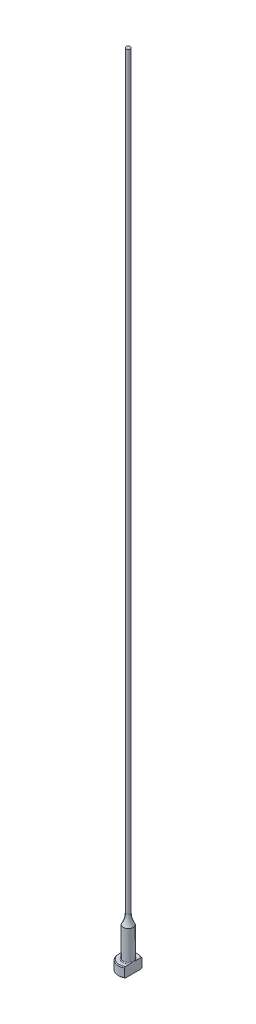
SolidWorks part; units mm, degrees
ref_plane "Front Plane" through (0, 0, 0) normal (0, 0, 1) x (1, 0, 0)
ref_plane "Top Plane" through (0, 0, 0) normal (0, 1, 0) x (1, 0, 0)
ref_plane "Right Plane" through (0, 0, 0) normal (1, 0, 0) x (0, 0, -1)
sketch "Sketch1" plane through (0, 0, 0) normal (0, 0, 1) x (1, 0, 0)
  line L0 (0, 259.9588) -> (0, -15.1925) construction
  line L1 (0, 0) -> (-3.175, 0)
  line L2 (-3.175, 0) -> (-3.175, 3.175)
  line L3 (-3.175, 3.175) -> (-1.5875, 3.175)
  line L4 (-0.6579, 16.0079) -> (-0.6579, 254)
  line L5 (-0.6579, 254) -> (0, 254)
  line L6 (0, 254) -> (0, 0)
  line L7 (-1.5875, 3.175) -> (-1.5875, 12.7)
  arc A0 (-1.5875, 12.7) -> (-0.6579, 16.0079) centre (-7.0079, 16.0079) ccw
  point P13 (-1.5875, 0)
  dimension "D1" = 6.35
  dimension "L" = 254
  dimension "D2" = 3.175
  dimension "H" = 6.35
  dimension "T" = 3.175
  dimension "D" = 1.3157
  dimension "S" = 12.7
revolve "Revolve1" add sketch "Sketch1" angle 360 about L0
chamfer "Chamfer1" distance 0.254 angle 45 2 edges at (0, 3.175, 3.175) (0, 0, 3.175)
fillet "Fillet1" radius 0.254 1 edges at (0, 3.175, 1.5875)
sketch "Sketch2" plane through (0, 0, 0) normal (0, 1, 0) x (1, 0, 0)
  line L0 (1.5875, -2.7496) -> (1.5875, 2.7496)
  circle A0 centre (0, 0) radius 3.175 construction
  arc A2 (1.5875, -2.7496) -> (1.5875, 2.7496) centre (0, 0) ccw
  circle A3 centre (0, 0) radius 3.175 construction
  circle A4 centre (0, 0) radius 1.5875 construction
extrude "Key Head" cut sketch "Sketch2" along normal up to next
